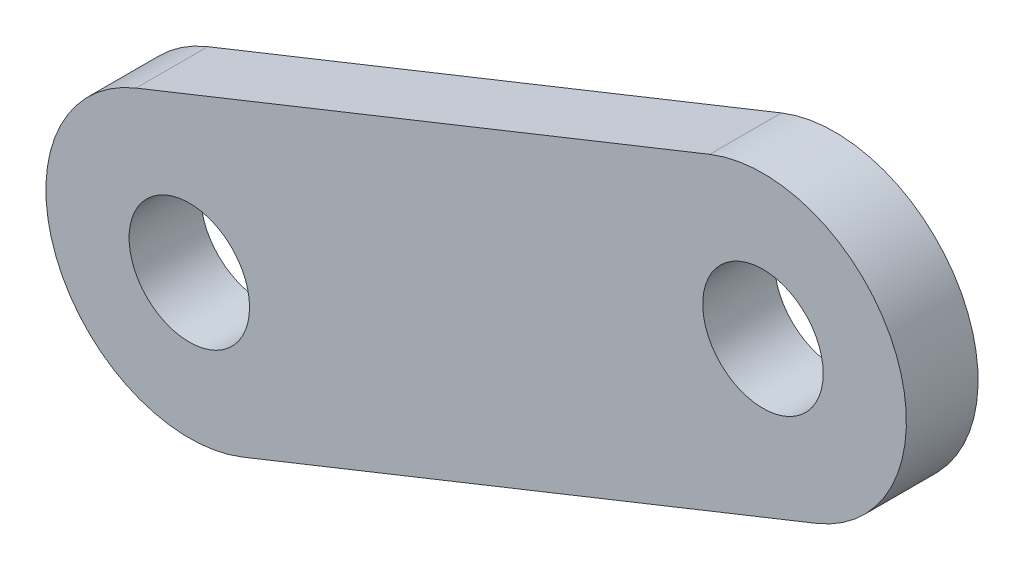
SolidWorks part; units mm, degrees
ref_plane "Alzado" through (0, 0, 0) normal (0, 0, 1) x (1, 0, 0)
ref_plane "Planta" through (0, 0, 0) normal (0, 1, 0) x (1, 0, 0)
ref_plane "Vista lateral" through (0, 0, 0) normal (1, 0, 0) x (0, 0, -1)
ref_plane "Plano1" through (0, 0, 66.4) normal (0, 0, 1) x (1, 0, 0)
sketch "Sk_Biela_exterior" plane through (0, 0, 66.4) normal (0, 0, 1) x (1, 0, 0)
  line L0 (-38.143, -40.6424) -> (-18.143, -32.6424)
  line L1 (-21.857, -23.3576) -> (-41.857, -31.3576)
  arc A0 (-18.143, -32.6424) -> (-21.857, -23.3576) centre (-20, -28) ccw
  arc A1 (-41.857, -31.3576) -> (-38.143, -40.6424) centre (-40, -36) ccw
  circle A2 centre (-20, -28) radius 2.1
  circle A3 centre (-40, -36) radius 2.1
extrude "Biela_exterior" add sketch "Sk_Biela_exterior" along normal blind 2.5
